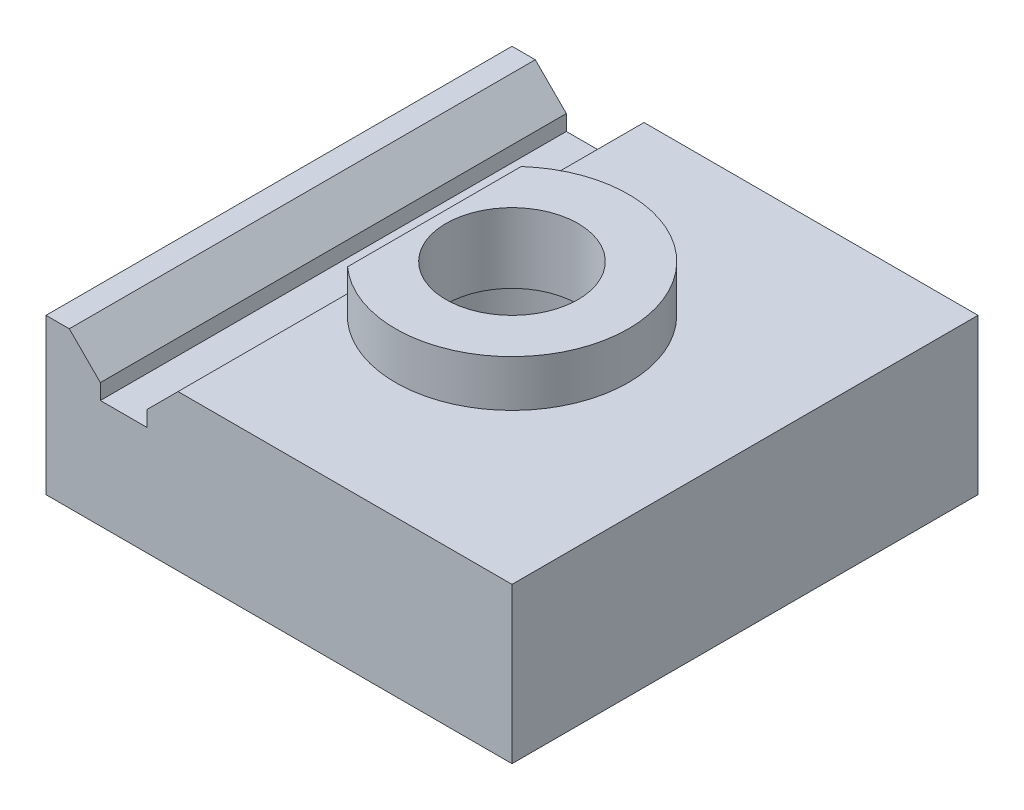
SolidWorks part; units mm, degrees
ref_plane "Ebene vorne" through (0, 0, 0) normal (0, 0, 1) x (1, 0, 0)
ref_plane "Ebene oben" through (0, 0, 0) normal (0, 1, 0) x (1, 0, 0)
ref_plane "Ebene rechts" through (0, 0, 0) normal (1, 0, 0) x (0, 0, -1)
sketch "Skizze1" plane through (0, 0, 0) normal (0, 0, 1) x (1, 0, 0)
  line L0 (-15, 10) -> (-15, 0)
  line L1 (-15, 0) -> (15, 0)
  line L2 (15, 0) -> (15, 10)
  line L3 (15, 10) -> (-6.5, 10)
  line L4 (-6.5, 10) -> (-8.5, 8)
  line L5 (-8.5, 8) -> (-8.5, 7)
  line L6 (-8.5, 7) -> (-11.5, 7)
  line L7 (-11.5, 7) -> (-11.5, 8)
  line L8 (-11.5, 8) -> (-13.5, 10)
  line L9 (-13.5, 10) -> (-15, 10)
  line L10 (-10, 14.3334) -> (-10, 5.782) construction
  line L11 (0, 13.281) -> (0, -3.0169) construction
  dimension "D1" = 10
  dimension "D2" = 30
  dimension "D3" = 10
  dimension "D4" = 3
  dimension "D5" = 1
  dimension "D6" = 3
extrude "Aufsatz-Linear austragen1" add sketch "Skizze1" along normal mid plane 30
sketch "Skizze4" plane through (0, 0, 0) normal (0, -1, 0) x (1, 0, 0)
  circle A0 centre (0, 0) radius 7.5
  dimension "D1" = 15
extrude "Aufsatz-Linear austragen2" [suppressed] add sketch "Skizze4" along normal offset from surface (1.5 mm away) 13
hole_wizard "Stirnsenkung für M2.5 Zylinderschraube mit Innensechskant1" positions "Skizze3" profile "Skizze2" counterbore size "M2.5" standard "DIN"
sketch "Skizze3" plane through (0, 11.5, 0) normal (0, 1, 0) x (-1, 0, 0)
  point P0 (0, 0)
sketch "Skizze2" plane through (0, 11.5, 0) normal (1, 0, 0) x (0, 0, 1)
  line L0 (0, 0) -> (0, 13)
  line L1 (0, 13) -> (4.25, 13)
  line L3 (4.25, 13) -> (4.25, 3.5)
  line L4 (4.25, 3.5) -> (7.5, 3.5)
  line L5 (7.5, 3.5) -> (7.5, 0)
  line L7 (7.5, 0) -> (0, 0)
  line L11 (0, -6.35) -> (0, 107.95) construction
  dimension "Bohrerdurchmesser" = 8.5
  dimension "Bohrungstiefe" = 13
  dimension "Senkdurchmesser2" = 15
  dimension "Senktiefe2" = 3.5
sketch "Skizze5" plane through (0, 10, 0) normal (0, 1, 0) x (1, 0, 0)
  line L0 (-5, 5.5902) -> (-5, -5.5902)
  arc A0 (-5, -5.5902) -> (-5, 5.5902) centre (0, 0) ccw
  dimension "D1" = 15
  dimension "D2" = 12.5
extrude "Aufsatz-Linear austragen3" add sketch "Skizze5" along normal offset from surface (3 mm away) 13
hole_wizard "Stirnsenkung für M2.5 Zylinderschraube mit Innensechskant2" positions "Skizze7" profile "Skizze6" counterbore size "M2.5" standard "DIN"
sketch "Skizze7" plane through (0, 0, 0) normal (0, -1, 0) x (1, 0, 0)
  point P0 (0, 0)
sketch "Skizze6" plane through (0, 0, 0) normal (1, 0, 0) x (0, 0, -1)
  line L0 (0, 0) -> (0, 13)
  line L1 (0, 13) -> (4.25, 13)
  line L3 (4.25, 13) -> (4.25, 8.5)
  line L4 (4.25, 8.5) -> (6.75, 8.5)
  line L5 (6.75, 8.5) -> (6.75, 0)
  line L7 (6.75, 0) -> (0, 0)
  line L11 (0, -6.35) -> (0, 107.95) construction
  dimension "Bohrerdurchmesser" = 8.5
  dimension "Bohrungstiefe" = 13
  dimension "Senkdurchmesser2" = 13.5
  dimension "Senktiefe2" = 8.5
